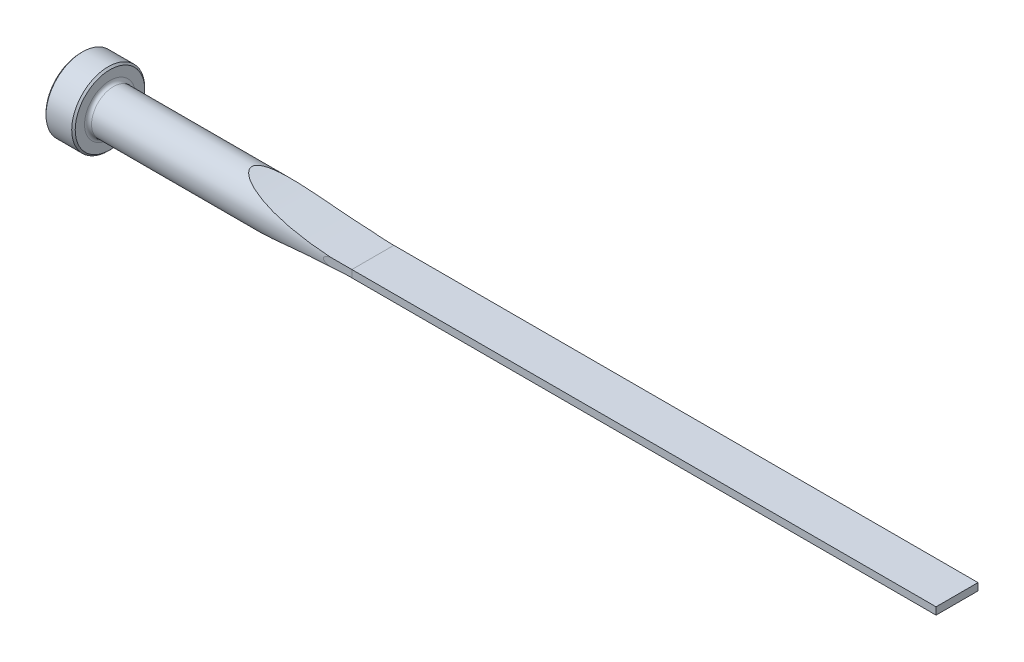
SolidWorks part; units mm, degrees
ref_plane "Front Plane" through (0, 0, 0) normal (0, 0, 1) x (1, 0, 0)
ref_plane "Top Plane" through (0, 0, 0) normal (0, 1, 0) x (1, 0, 0)
ref_plane "Right Plane" through (0, 0, 0) normal (1, 0, 0) x (0, 0, -1)
sketch "Sketch1" plane through (0, 0, 0) normal (0, 0, 1) x (1, 0, 0)
  line L0 (0, 0) -> (175.5286, 0) construction
  line L1 (0, 0) -> (0, 7.9375)
  line L2 (0, 7.9375) -> (6.35, 7.9375)
  line L3 (6.35, 7.9375) -> (6.35, 4.7625)
  line L4 (6.35, 4.7625) -> (190.5, 4.7625)
  line L5 (190.5, 4.7625) -> (190.5, 0)
  line L6 (190.5, 0) -> (0, 0)
  dimension "D1" = 190.5
  dimension "D2" = 15.875
  dimension "D3" = 9.525
  dimension "D4" = 6.35
revolve "Revolve1" add sketch "Sketch1" angle 360 about L0
sketch "Sketch2" plane through (0, 0, 0) normal (0, 0, 1) x (1, 0, 0)
  line L0 (190.5, 4.7625) -> (190.5, 0.7874)
  line L1 (190.5, -4.7625) -> (190.5, 4.7625) construction
  line L2 (190.5, 0.7874) -> (63.5, 0.7874)
  line L3 (190.5, 4.7625) -> (6.35, 4.7625) construction
  line L4 (37.2137, 4.7625) -> (190.5, 4.7625)
  line L5 (166.0833, 0) -> (153.1705, 0) construction
  arc A0 (63.5, 0.7874) -> (37.2137, 4.7625) centre (63.5, 89.6874) cw
  dimension "D1" = 88.9
  dimension "D3" = 127
  dimension "D2" = 1.5748
  dimension "D4" = 26.2863
extrude "Cut-Extrude1" cut sketch "Sketch2" against normal through all both and the other way through all
mirror "Mirror1" about plane through (0, 0, 0) normal (0, 1, 0) of "Cut-Extrude1"
sketch "Sketch3" plane through (0, 0, 0) normal (0, 1, 0) x (1, 0, 0)
  line L0 (190.5, 4.7625) -> (190.5, 4.5593)
  line L1 (190.5, 4.697) -> (190.5, -4.697) construction
  line L2 (190.5, 4.5593) -> (63.5, 4.5593)
  line L3 (190.5, 4.7625) -> (6.35, 4.7625) construction
  line L4 (57.4927, 4.7625) -> (190.5, 4.7625)
  line L5 (163.4716, 0) -> (166.2513, 0) construction
  line L6 (63.5, 4.697) -> (63.5, -4.697) construction
  arc A0 (63.5, 4.5593) -> (57.4927, 4.7625) centre (63.5, 93.4593) cw
  dimension "D2" = 88.9
  dimension "D1" = 9.1186
extrude "Cut-Extrude2" cut sketch "Sketch3" against normal through all both and the other way through all
mirror "Mirror2" about plane through (0, 0, 0) normal (0, 0, 1) of "Cut-Extrude2"
fillet "Fillet1" radius 0.762 1 edges at (6.35, 0, 4.7625)
chamfer "Chamfer1" distance 0.381 angle 45 2 edges at (0, 0, 7.9375) (6.35, 0, 7.9375)
